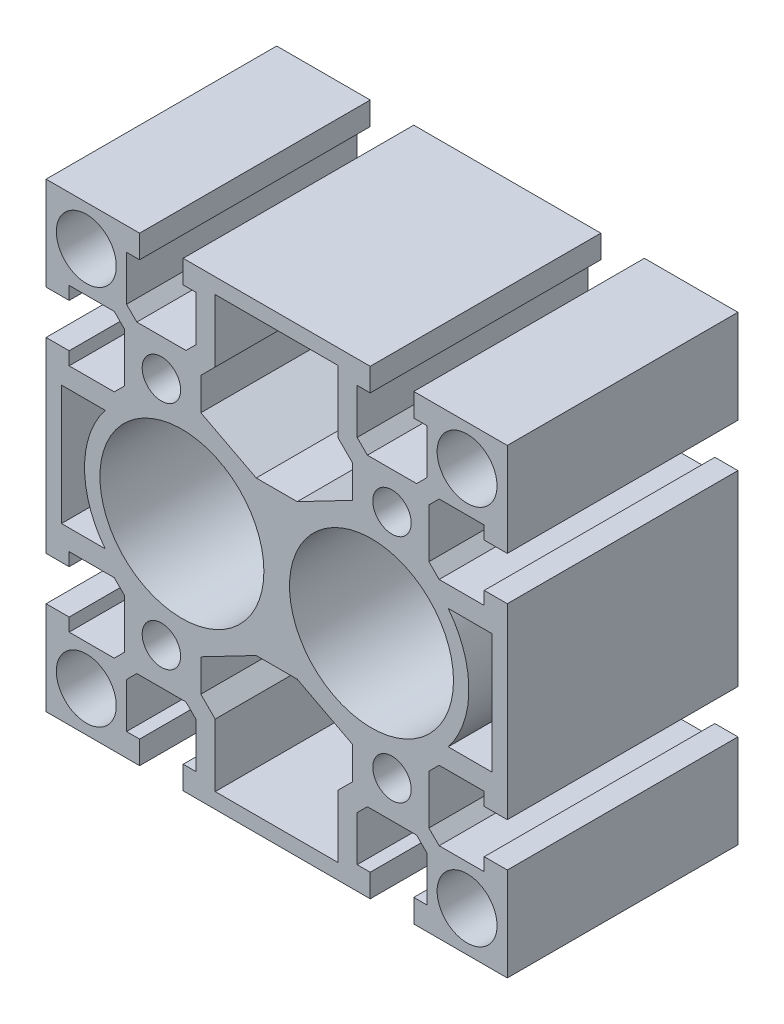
SolidWorks part; units mm, degrees
ref_plane "Front Plane" through (0, 0, 0) normal (0, 0, 1) x (1, 0, 0)
ref_plane "Top Plane" through (0, 0, 0) normal (0, 1, 0) x (1, 0, 0)
ref_plane "Right Plane" through (0, 0, 0) normal (1, 0, 0) x (0, 0, -1)
sketch "Sketch1" plane through (0, 0, 0) normal (0, 0, 1) x (1, 0, 0)
  line L3 (41.9999, 11.7) -> (41.9999, -11.7)
  line L4 (41.9999, -11.7) -> (33.4702, -11.7)
  line L5 (33.4702, 11.7) -> (41.9999, 11.7)
  line L16 (14.8, -26.9431) -> (12, -29.7431)
  line L17 (12, -29.7431) -> (12, -41.9999)
  line L18 (12, -41.9999) -> (-12, -41.9999)
  line L19 (-12, -41.9999) -> (-12, -29.7431)
  line L20 (-12, -29.7431) -> (-14.8, -26.9431)
  line L21 (-14.8, -26.9431) -> (-14.8, -20.6209)
  line L22 (14.8, -20.6209) -> (14.8, -26.9431)
  line L23 (4, -15) -> (14.8, -20.6209)
  line L24 (-4, -15) -> (4, -15)
  line L25 (-14.8, -20.6209) -> (-4, -15)
  line L29 (-33.4702, -11.7) -> (-41.9999, -11.7)
  line L30 (-41.9999, -11.7) -> (-41.9999, 11.7)
  line L31 (-41.9999, 11.7) -> (-33.4702, 11.7)
  line L42 (12, 41.9999) -> (12, 29.7431)
  line L43 (12, 29.7431) -> (14.8, 26.9431)
  line L44 (14.8, 26.9431) -> (14.8, 20.6209)
  line L45 (14.8, 20.6209) -> (4, 15)
  line L46 (4, 15) -> (-4, 15)
  line L47 (-4, 15) -> (-14.8, 20.6209)
  line L48 (-14.8, 20.6209) -> (-14.8, 26.9431)
  line L49 (-14.8, 26.9431) -> (-12, 29.7431)
  line L50 (-12, 29.7431) -> (-12, 41.9999)
  line L51 (-12, 41.9999) -> (12, 41.9999)
  line L168 (-44.9999, -18.25) -> (-40.4999, -18.25)
  line L169 (-40.4999, -18.25) -> (-40.4999, -15.7)
  line L170 (-40.4999, -15.7) -> (-31.6999, -15.7)
  line L171 (-31.6999, -15.7) -> (-29.7, -17.7)
  line L172 (-29.7, -17.7) -> (-29.7, -27.3)
  line L173 (-29.7, -27.3) -> (-31.6999, -29.3)
  line L174 (-31.6999, -29.3) -> (-40.4999, -29.3)
  line L175 (-40.4999, -29.3) -> (-40.4999, -26.7499)
  line L176 (-40.4999, -26.7499) -> (-44.9999, -26.7499)
  line L177 (-44.9999, -26.7499) -> (-44.9999, -44.9999)
  line L178 (-44.9999, -44.9999) -> (-26.7499, -44.9999)
  line L179 (-26.7499, -44.9999) -> (-26.7499, -40.4999)
  line L180 (-26.7499, -40.4999) -> (-29.3, -40.4999)
  line L181 (-29.3, -40.4999) -> (-29.3, -31.6999)
  line L182 (-29.3, -31.6999) -> (-27.3, -29.7)
  line L183 (-27.3, -29.7) -> (-17.7, -29.7)
  line L184 (-17.7, -29.7) -> (-15.7, -31.6999)
  line L185 (-15.7, -31.6999) -> (-15.7, -40.4999)
  line L186 (-15.7, -40.4999) -> (-18.25, -40.4999)
  line L187 (-18.25, -40.4999) -> (-18.25, -44.9999)
  line L188 (-18.25, -44.9999) -> (18.25, -44.9999)
  line L189 (18.25, -44.9999) -> (18.25, -40.4999)
  line L190 (18.25, -40.4999) -> (15.7, -40.4999)
  line L191 (15.7, -40.4999) -> (15.7, -31.6999)
  line L192 (15.7, -31.6999) -> (17.6999, -29.7)
  line L193 (17.6999, -29.7) -> (27.2999, -29.7)
  line L194 (27.2999, -29.7) -> (29.2999, -31.6999)
  line L195 (29.2999, -31.6999) -> (29.2999, -40.4999)
  line L196 (29.2999, -40.4999) -> (26.7499, -40.4999)
  line L197 (26.7499, -40.4999) -> (26.7499, -44.9999)
  line L198 (26.7499, -44.9999) -> (44.9999, -44.9999)
  line L199 (44.9999, -44.9999) -> (44.9999, -26.7499)
  line L200 (44.9999, -26.7499) -> (40.4999, -26.7499)
  line L201 (40.4999, -26.7499) -> (40.4999, -29.3)
  line L202 (40.4999, -29.3) -> (31.6999, -29.3)
  line L203 (31.6999, -29.3) -> (29.7, -27.3)
  line L204 (29.7, -27.3) -> (29.7, -17.7)
  line L205 (29.7, -17.7) -> (31.6999, -15.7)
  line L206 (31.6999, -15.7) -> (40.4999, -15.7)
  line L207 (40.4999, -15.7) -> (40.4999, -18.25)
  line L208 (40.4999, -18.25) -> (44.9999, -18.25)
  line L209 (44.9999, -18.25) -> (44.9999, 18.25)
  line L210 (44.9999, 18.25) -> (40.4999, 18.25)
  line L211 (40.4999, 18.25) -> (40.4999, 15.7)
  line L212 (40.4999, 15.7) -> (31.6999, 15.7)
  line L213 (31.6999, 15.7) -> (29.7, 17.7)
  line L214 (29.7, 17.7) -> (29.7, 27.3)
  line L215 (29.7, 27.3) -> (31.6999, 29.3)
  line L216 (31.6999, 29.3) -> (40.4999, 29.3)
  line L217 (40.4999, 29.3) -> (40.4999, 26.7499)
  line L218 (40.4999, 26.7499) -> (44.9999, 26.7499)
  line L219 (44.9999, 26.7499) -> (44.9999, 44.9999)
  line L220 (44.9999, 44.9999) -> (26.7499, 44.9999)
  line L221 (26.7499, 44.9999) -> (26.7499, 40.4999)
  line L222 (26.7499, 40.4999) -> (29.2999, 40.4999)
  line L223 (29.2999, 40.4999) -> (29.2999, 31.6999)
  line L224 (29.2999, 31.6999) -> (27.2999, 29.7)
  line L225 (27.2999, 29.7) -> (17.6999, 29.7)
  line L226 (17.6999, 29.7) -> (15.7, 31.6999)
  line L227 (15.7, 31.6999) -> (15.7, 40.4999)
  line L228 (15.7, 40.4999) -> (18.25, 40.4999)
  line L229 (18.25, 40.4999) -> (18.25, 44.9999)
  line L230 (18.25, 44.9999) -> (-18.25, 44.9999)
  line L231 (-18.25, 44.9999) -> (-18.25, 40.4999)
  line L232 (-18.25, 40.4999) -> (-15.7, 40.4999)
  line L233 (-15.7, 40.4999) -> (-15.7, 31.6999)
  line L234 (-15.7, 31.6999) -> (-17.7, 29.7)
  line L235 (-17.7, 29.7) -> (-27.3, 29.7)
  line L236 (-27.3, 29.7) -> (-29.3, 31.6999)
  line L237 (-29.3, 31.6999) -> (-29.3, 40.4999)
  line L238 (-29.3, 40.4999) -> (-26.7499, 40.4999)
  line L239 (-26.7499, 40.4999) -> (-26.7499, 44.9999)
  line L240 (-26.7499, 44.9999) -> (-44.9999, 44.9999)
  line L241 (-44.9999, 44.9999) -> (-44.9999, 26.7499)
  line L242 (-44.9999, 26.7499) -> (-40.4999, 26.7499)
  line L243 (-40.4999, 26.7499) -> (-40.4999, 29.3)
  line L244 (-40.4999, 29.3) -> (-31.6999, 29.3)
  line L245 (-31.6999, 29.3) -> (-29.7, 27.3)
  line L246 (-29.7, 27.3) -> (-29.7, 17.7)
  line L247 (-29.7, 17.7) -> (-31.6999, 15.7)
  line L248 (-31.6999, 15.7) -> (-40.4999, 15.7)
  line L249 (-40.4999, 15.7) -> (-40.4999, 18.25)
  line L250 (-40.4999, 18.25) -> (-44.9999, 18.25)
  line L251 (-44.9999, 18.25) -> (-44.9999, -18.25)
  circle A8 centre (-37.1499, -37.1499) radius 5.85
  circle A9 centre (-22.5, -22.5) radius 3.75
  circle A10 centre (22.5, -22.5) radius 3.75
  circle A11 centre (37.1499, -37.1499) radius 5.85
  circle A12 centre (37.1499, 37.1499) radius 5.85
  circle A13 centre (22.5, 22.5) radius 3.75
  circle A14 centre (-22.5, 22.5) radius 3.75
  circle A15 centre (-37.1499, 37.1499) radius 5.85
  circle A18 centre (18.5, 0) radius 16
  circle A19 centre (-18.5, 0) radius 16
  arc A21 (33.4702, -11.7) -> (33.4702, 11.7) centre (18.5, 0) ccw
  arc A23 (-33.4702, 11.7) -> (-33.4702, -11.7) centre (-18.5, 0) ccw
extrude "Extrude1" add sketch "Sketch1" along normal blind 45
sketch "Sketch2" plane through (0, 44.9999, 0) normal (0, 1, 0) x (1, 0, 0)
  line L0 (-44.9999, -45) -> (-44.9999, 0) construction
  line L1 (-26.7499, 0) -> (-44.9999, 0) construction
  line L2 (44.9999, -45) -> (44.9999, 0) construction
  line L3 (44.9999, 0) -> (26.7499, 0) construction
  point P0 (-22.4999, -22.5)
  point P1 (22.4999, -22.5)
  dimension "D1" = 22.5
  dimension "D2" = 22.5
  dimension "D3" = 22.5
  dimension "D4" = 22.5
hole_wizard "Ø15.0 (15) Diameter Hole1" positions "3DSketch1" profile "Sketch3" hole size "Ø15.0" standard "Ansi Metric"
sketch3d "3DSketch1"
  point P0 (-22.4999, 44.9999, 22.5)
  point P3 (22.4999, 44.9999, 22.5)
sketch "Sketch3" plane through (-22.4999, 44.9999, 22.5) normal (1, 0, 0) x (0, 0, 1)
  line L0 (0, 0) -> (0, 40.5635)
  line L1 (0, 40.5635) -> (4.1, 38.1)
  line L2 (4.1, 38.1) -> (4.1, 0)
  line L5 (4.1, 0) -> (0, 0)
  line L10 (0, 40.5635) -> (-4.1, 38.1) construction
  line L11 (0, -6.35) -> (0, 107.95) construction
  dimension "Hole Dia." = 8.2
  dimension "Hole Depth" = 38.1
  dimension "Drill Angle" = 118
